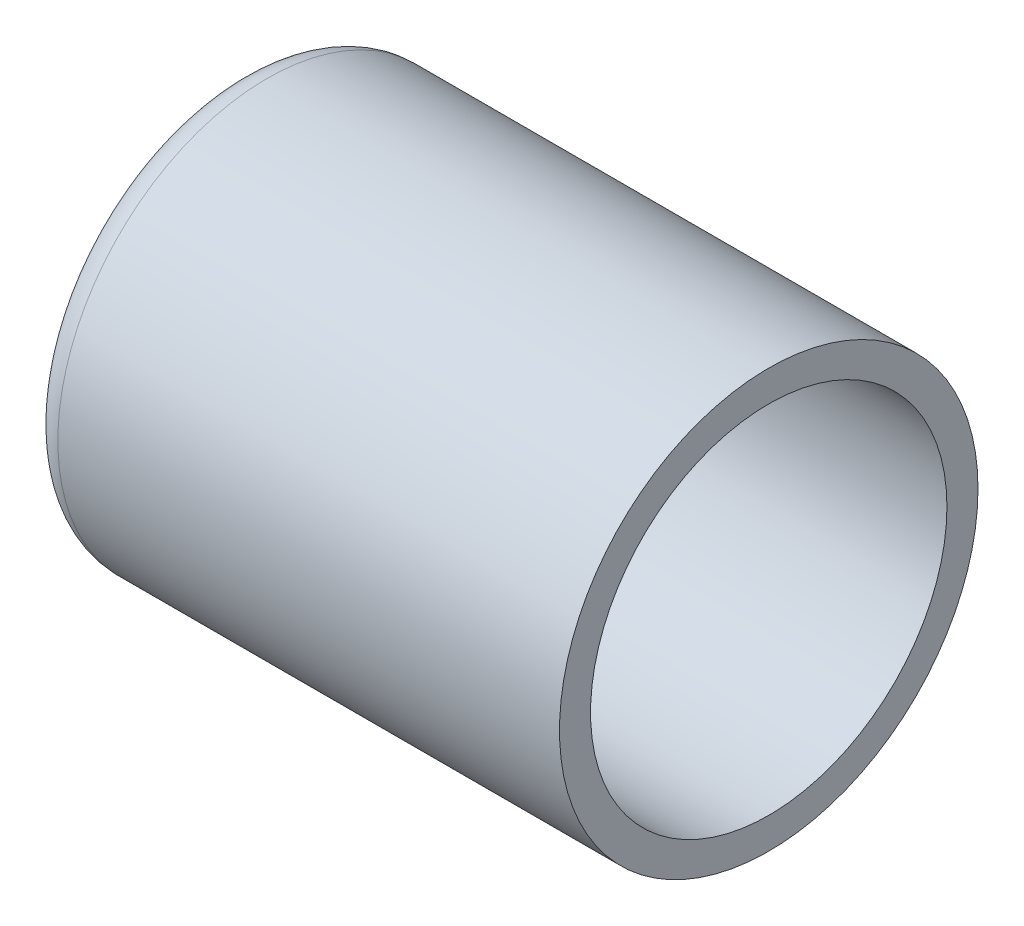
SolidWorks part; units mm, degrees
ref_plane "Front Plane" through (0, 0, 0) normal (0, 0, 1) x (1, 0, 0)
ref_plane "Top Plane" through (0, 0, 0) normal (0, 1, 0) x (1, 0, 0)
ref_plane "Right Plane" through (0, 0, 0) normal (1, 0, 0) x (0, 0, -1)
sketch "Sketch1" plane through (0, 0, 0) normal (1, 0, 0) x (0, 0, -1)
  circle A0 centre (0, 0) radius 5.5626
  dimension "D1" = 11.1252
extrude "Boss-Extrude1" add sketch "Sketch1" along normal blind 14.097
sketch "Sketch2" plane through (14.097, 0, 0) normal (1, 0, 0) x (0, 0, -1)
  circle A0 centre (0, 0) radius 4.7371
  dimension "D1" = 9.4742
extrude "Cut-Extrude1" cut sketch "Sketch2" against normal blind 11.684
fillet "Fillet1" radius 0.762 1 edges at (0, 0, -5.5626)
sketch "Sketch3" plane through (0, 0, 0) normal (-1, 0, 0) x (0, 0, 1)
  circle A0 centre (0, 0) radius 1.5875
  dimension "D1" = 3.175
extrude "Cut-Extrude2" cut sketch "Sketch3" against normal up to next
chamfer "Chamfer1" distance 0.635 angle 45 1 edges at (0, 0, 1.5875)
